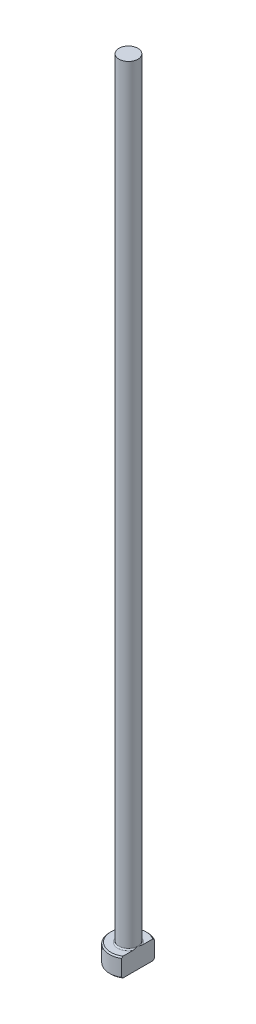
SolidWorks part; units mm, degrees
ref_plane "Front Plane" through (0, 0, 0) normal (0, 0, 1) x (1, 0, 0)
ref_plane "Top Plane" through (0, 0, 0) normal (0, 1, 0) x (1, 0, 0)
ref_plane "Right Plane" through (0, 0, 0) normal (1, 0, 0) x (0, 0, -1)
sketch "Sketch1" plane through (0, 0, 0) normal (0, 0, 1) x (1, 0, 0)
  line L0 (0, 259.9588) -> (0, -15.1925) construction
  line L1 (0, 0) -> (-3, 0)
  line L2 (-3, 0) -> (-3, 3)
  line L3 (-3, 3) -> (-1.5, 3)
  line L4 (-1.5, 3) -> (-1.5, 125)
  line L5 (-1.5, 125) -> (0, 125)
  line L6 (0, 125) -> (0, 0)
  dimension "L" = 125
  dimension "H" = 6
  dimension "T" = 3
  dimension "D" = 3
revolve "Revolve1" add sketch "Sketch1" angle 360 about L0
chamfer "Chamfer1" distance 0.2 angle 45 2 edges at (0, 3, 3) (0, 0, 3)
fillet "Fillet1" radius 0.2 1 edges at (0, 3, 1.5)
sketch "Sketch2" plane through (0, 0, 0) normal (0, 1, 0) x (1, 0, 0)
  line L0 (1.5, 2.5981) -> (1.5, -2.5981)
  circle A0 centre (0, 0) radius 3 construction
  arc A1 (1.5, -2.5981) -> (1.5, 2.5981) centre (0, 0) ccw
  circle A2 centre (0, 0) radius 1.5 construction
extrude "KEY" cut sketch "Sketch2" along normal through all
